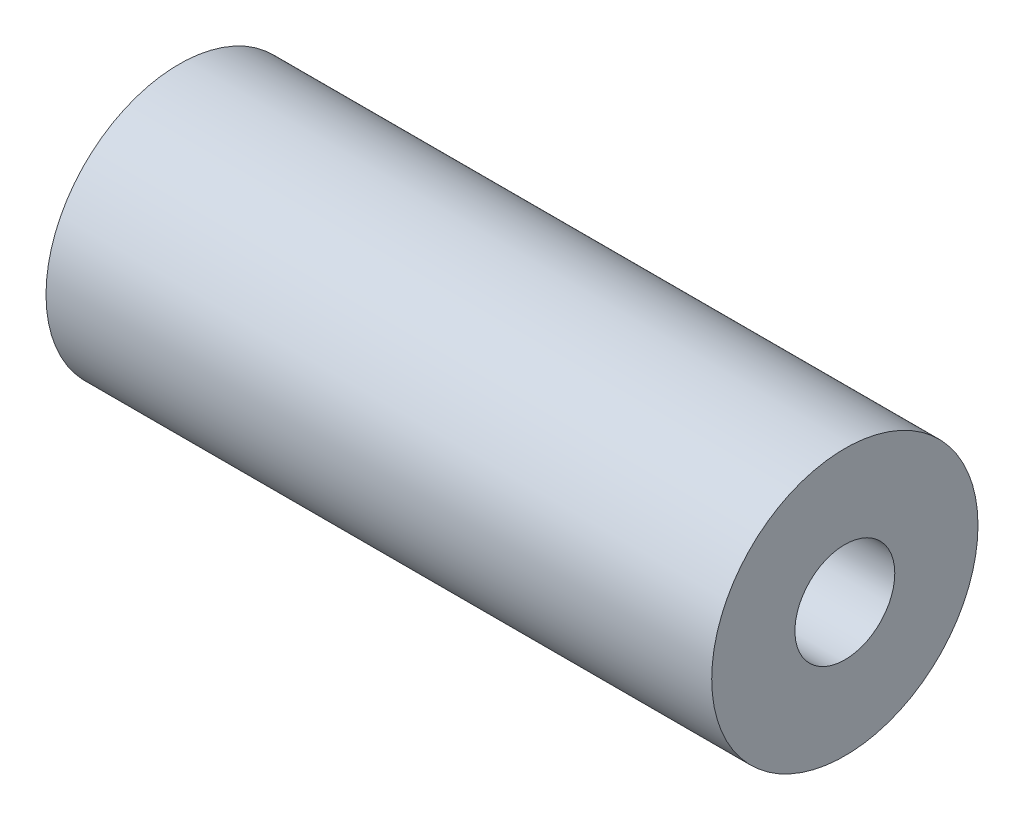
SolidWorks part; units mm, degrees
ref_plane "Front Plane" through (0, 0, 0) normal (0, 0, 1) x (1, 0, 0)
ref_plane "Top Plane" through (0, 0, 0) normal (0, 1, 0) x (1, 0, 0)
ref_plane "Right Plane" through (0, 0, 0) normal (1, 0, 0) x (0, 0, -1)
sketch "Sketch1" plane through (0, 0, 0) normal (1, 0, 0) x (0, 0, -1)
  circle A0 centre (0, 0) radius 12.7
  circle A1 centre (0, 0) radius 4.7625
  dimension "D1" = 25.4
  dimension "D2" = 9.525
extrude "Extrude1" add sketch "Sketch1" along normal blind 63.5
